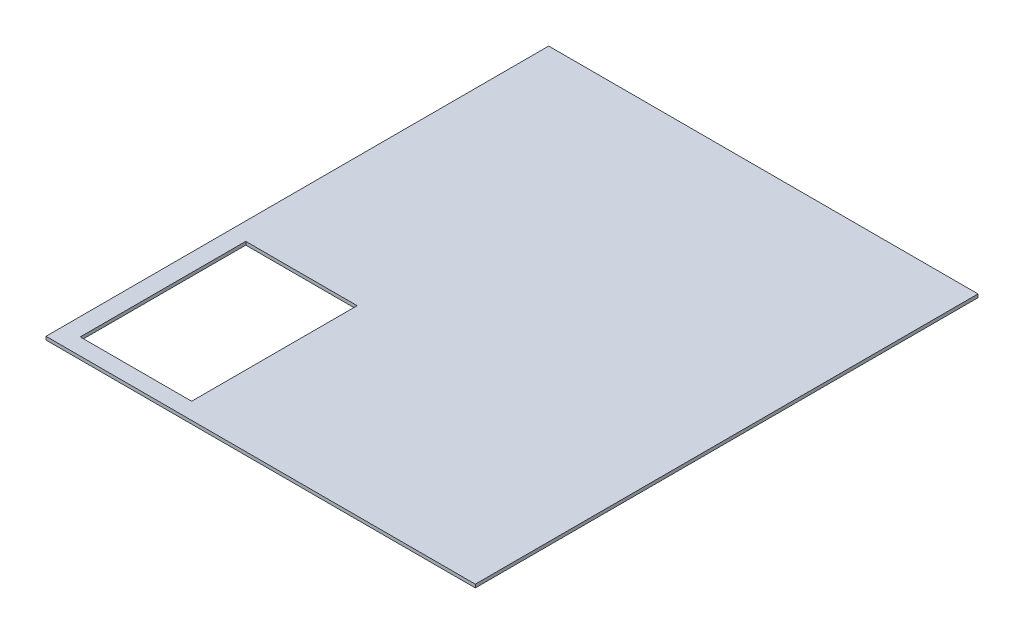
SolidWorks part; units mm, degrees
ref_plane "Alzado" through (0, 0, 0) normal (0, 0, 1) x (1, 0, 0)
ref_plane "Planta" through (0, 0, 0) normal (0, 1, 0) x (1, 0, 0)
ref_plane "Vista lateral" through (0, 0, 0) normal (1, 0, 0) x (0, 0, -1)
sketch "Sketch1" plane through (0, 0, 0) normal (0, 1, 0) x (1, 0, 0)
  line L1 (0, 0) -> (389, 0)
  line L2 (0, 0) -> (0, 455.5)
  line L3 (0, 455.5) -> (389, 455.5)
  line L4 (389, 0) -> (389, 455.5)
  dimension "D1" = 389
  dimension "D2" = 455.5
extrude "Boss-Extrude1" add sketch "Sketch1" along normal blind 3
sketch "Sketch2" plane through (0, 3, 0) normal (0, 1, 0) x (1, 0, 0)
  line L0 (0, 0) -> (389, 0) construction
  line L1 (16, 15) -> (116.9602, 15)
  line L2 (16, 15) -> (16, 165)
  line L3 (16, 165) -> (116.9602, 165)
  line L4 (116.9602, 15) -> (116.9602, 165)
  line L5 (0, 455.5) -> (0, 0) construction
  dimension "D1" = 15
  dimension "D2" = 16
  dimension "D3" = 100.9602
  dimension "D4" = 150
extrude "Cut-Extrude1" cut sketch "Sketch2" against normal through all
